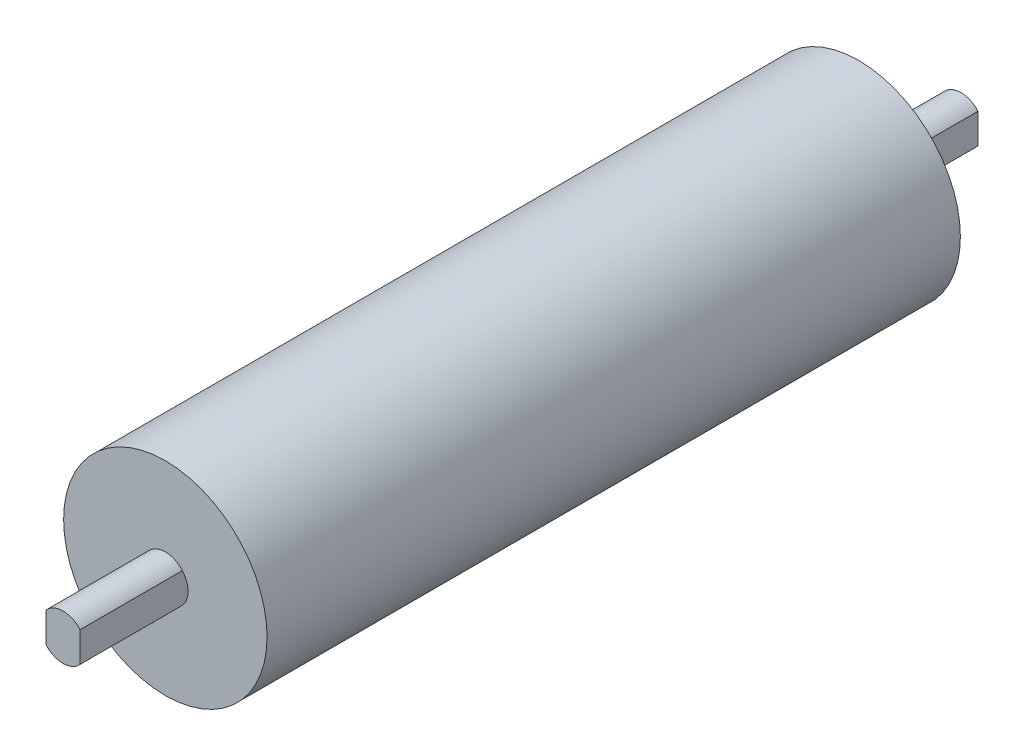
SolidWorks part; units mm, degrees
ref_plane "前视基准面" through (0, 0, 0) normal (0, 0, 1) x (1, 0, 0)
ref_plane "上视基准面" through (0, 0, 0) normal (0, 1, 0) x (1, 0, 0)
ref_plane "右视基准面" through (0, 0, 0) normal (1, 0, 0) x (0, 0, -1)
sketch "草图1" plane through (0, 0, 0) normal (0, 0, 1) x (1, 0, 0)
  circle A0 centre (0, 0) radius 44.75
  dimension "D1" = 89.5
extrude "拉伸1" add sketch "草图1" along normal mid plane 305
sketch "草图2" plane through (0, 0, 152.5) normal (0, 0, 1) x (1, 0, 0)
  circle A0 centre (0, 0) radius 10
  dimension "D1" = 20
extrude "拉伸2" add sketch "草图2" along normal blind 45
sketch "草图3" plane through (0, 0, 197.5) normal (0, 0, 1) x (1, 0, 0)
  line L0 (-7.5, 6.6144) -> (-7.5, -6.6144)
  line L1 (7.5, 6.6144) -> (7.5, -6.6144)
  arc A0 (7.5, -6.6144) -> (7.5, 6.6144) centre (0, 0) ccw
  circle A1 centre (0, 0) radius 10
  arc A2 (-7.5, 6.6144) -> (-7.5, -6.6144) centre (0, 0) ccw
  dimension "D2" = 15
  dimension "D3" = 7.5
  dimension "D1" = 0
extrude "切除-拉伸1" cut sketch "草图3" against normal up to surface (350 mm away)
mirror "镜向1" about plane through (0, 0, 0) normal (0, 0, 1) of "切除-拉伸1", "拉伸2"
